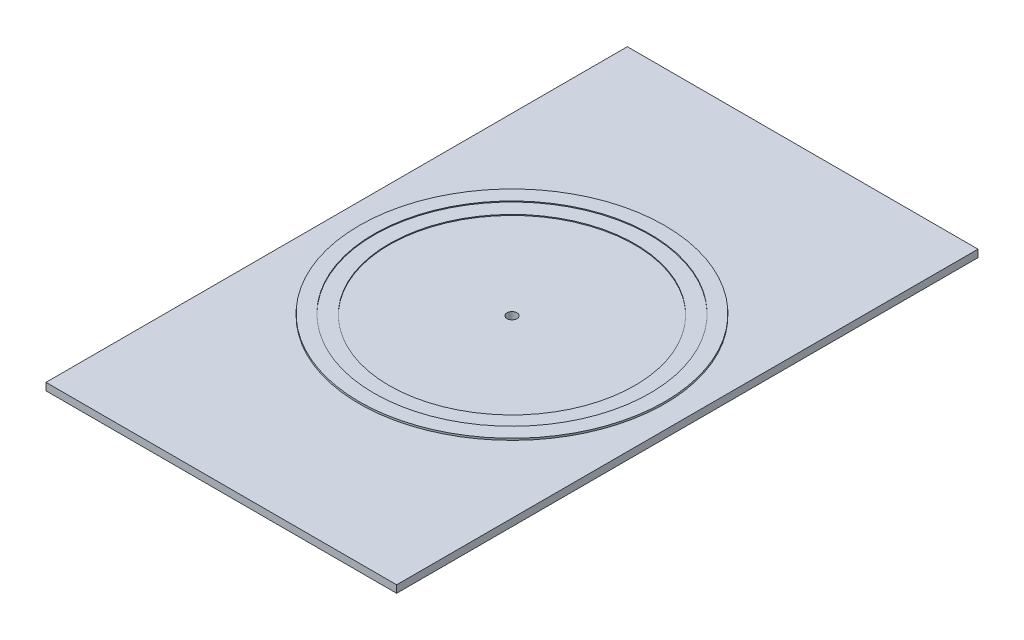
SolidWorks part; units mm, degrees
ref_plane "Front Plane" through (0, 0, 0) normal (0, 0, 1) x (1, 0, 0)
ref_plane "Top Plane" through (0, 0, 0) normal (0, 1, 0) x (1, 0, 0)
ref_plane "Right Plane" through (0, 0, 0) normal (1, 0, 0) x (0, 0, -1)
sketch "Sketch1" plane through (0, 0, 0) normal (0, 1, 0) x (1, 0, 0)
  line L1 (-95, -157.5) -> (95, -157.5)
  line L2 (-95, -157.5) -> (-95, 157.5)
  line L3 (-95, 157.5) -> (95, 157.5)
  line L4 (95, -157.5) -> (95, 157.5)
  line L5 (-95, -157.5) -> (95, 157.5) construction
  line L6 (-95, 157.5) -> (95, -157.5) construction
  circle A0 centre (0, 0) radius 2.75
  point P0 (0, 0)
  dimension "D3" = 5.5
  dimension "D1" = 190
  dimension "D2" = 315
extrude "Boss-Extrude1" add sketch "Sketch1" along normal blind 4
sketch "Sketch2" plane through (0, 4, 0) normal (0, 1, 0) x (1, 0, 0)
  circle A0 centre (0, 0) radius 82.725
  circle A1 centre (0, 0) radius 74.765
  dimension "D1" = 165.45
  dimension "D2" = 149.53
extrude "Boss-Extrude2" add sketch "Sketch2" along normal blind 1
sketch "Sketch3" plane through (0, 4, 0) normal (0, 1, 0) x (1, 0, 0)
  circle A0 centre (0, 0) radius 74.765
  circle A1 centre (0, 0) radius 66.555
  circle A2 centre (0, 0) radius 74.765 construction
  dimension "D1" = 8.21
extrude "Boss-Extrude3" add sketch "Sketch3" along normal blind 0.5
sketch "Sketch4" plane through (0, 0, 0) normal (0, -1, 0) x (1, 0, 0)
  line L10 (-93, 7.5) -> (-93, -7.5) construction
  line L14 (93, 155.5) -> (-93, 155.5)
  line L15 (93, -155.5) -> (93, 155.5)
  line L16 (-93, -155.5) -> (93, -155.5)
  line L17 (-93, 155.5) -> (-93, -155.5)
  line L18 (93, 155.5) -> (-93, 155.5) construction
  line L19 (93, -155.5) -> (93, 155.5) construction
  line L20 (-93, -155.5) -> (93, -155.5) construction
  line L21 (-93, 155.5) -> (-93, -155.5) construction
  circle A0 centre (-93, 155.5) radius 1
  circle A1 centre (0, 155.5) radius 1
  circle A2 centre (93, 155.5) radius 1
  circle A3 centre (93, 0) radius 1
  circle A4 centre (93, -155.5) radius 1
  circle A5 centre (0, -155.5) radius 1
  circle A6 centre (-93, -155.5) radius 1
  circle A7 centre (-93, 7.5) radius 1
  circle A8 centre (-93, -7.5) radius 1
  point P18 (-93, 0)
  dimension "D3" = 2
  dimension "D2" = 15
  dimension "D1" = 2
extrude "Cut-Extrude1" cut sketch "Sketch4" against normal blind 2
